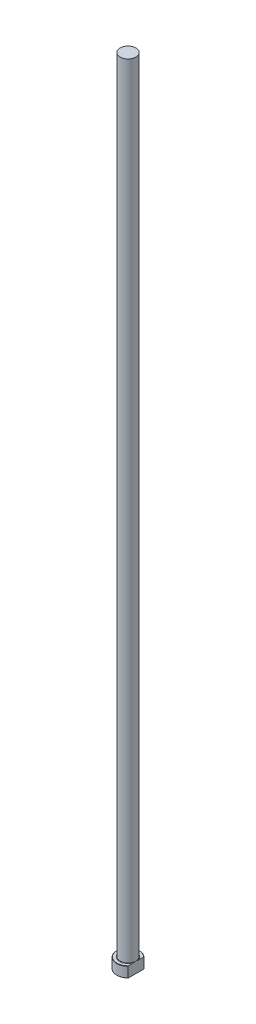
SolidWorks part; units mm, degrees
ref_plane "Front Plane" through (0, 0, 0) normal (0, 0, 1) x (1, 0, 0)
ref_plane "Top Plane" through (0, 0, 0) normal (0, 1, 0) x (1, 0, 0)
ref_plane "Right Plane" through (0, 0, 0) normal (1, 0, 0) x (0, 0, -1)
sketch "Sketch1" plane through (0, 0, 0) normal (0, 0, 1) x (1, 0, 0)
  line L0 (0, 259.9588) -> (0, -15.1925) construction
  line L1 (0, 0) -> (-8.5, 0)
  line L2 (-8.5, 0) -> (-8.5, 8)
  line L3 (-8.5, 8) -> (-6, 8)
  line L4 (-6, 8) -> (-6, 600)
  line L5 (-6, 600) -> (0, 600)
  line L6 (0, 600) -> (0, 0)
  dimension "L" = 600
  dimension "H" = 17
  dimension "T" = 8
  dimension "D" = 12
revolve "Revolve1" add sketch "Sketch1" angle 360 about L0
chamfer "Chamfer1" distance 0.2 angle 45 2 edges at (0, 8, 8.5) (0, 0, 8.5)
fillet "Fillet1" radius 0.3 1 edges at (0, 8, 6)
sketch "Sketch2" plane through (0, 0, 0) normal (0, 1, 0) x (1, 0, 0)
  line L0 (6, -6.0208) -> (6, 6.0208)
  circle A0 centre (0, 0) radius 8.5 construction
  arc A1 (6, -6.0208) -> (6, 6.0208) centre (0, 0) ccw
  circle A2 centre (0, 0) radius 6 construction
extrude "KEYED HEAD" cut sketch "Sketch2" along normal through all
